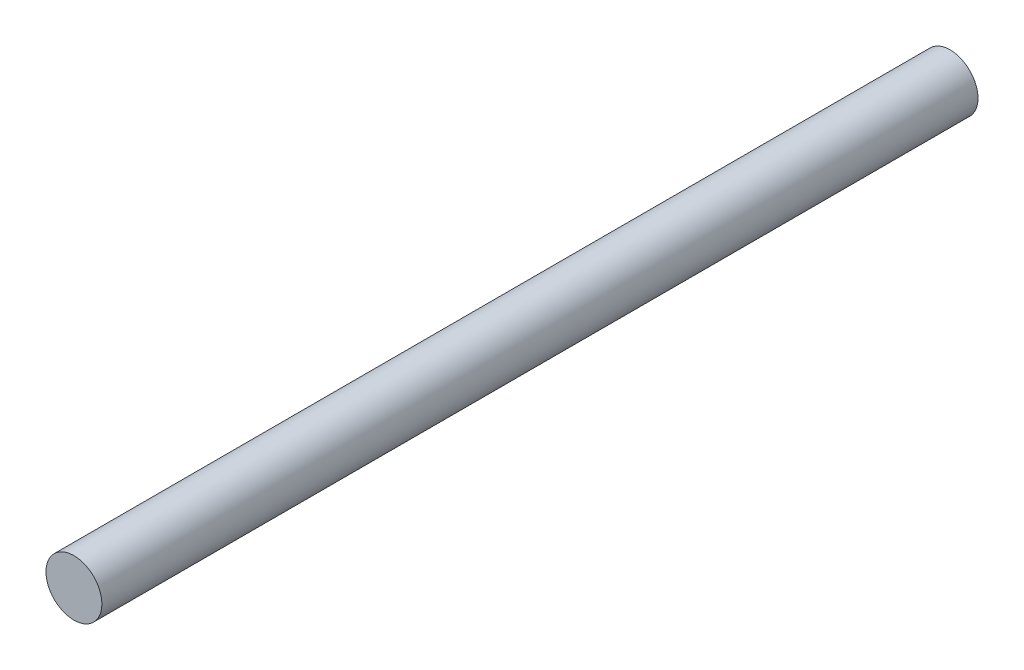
SolidWorks part; units mm, degrees
ref_plane "Plan de face" through (0, 0, 0) normal (0, 0, 1) x (1, 0, 0)
ref_plane "Plan de dessus" through (0, 0, 0) normal (0, 1, 0) x (1, 0, 0)
ref_plane "Plan de droite" through (0, 0, 0) normal (1, 0, 0) x (0, 0, -1)
sketch "Esquisse1" plane through (0, 0, 0) normal (0, 0, 1) x (1, 0, 0)
  circle A0 centre (0, 0) radius 3
  dimension "D1" = 6
extrude "Boss.-Extru.1" add sketch "Esquisse1" along normal blind 94
